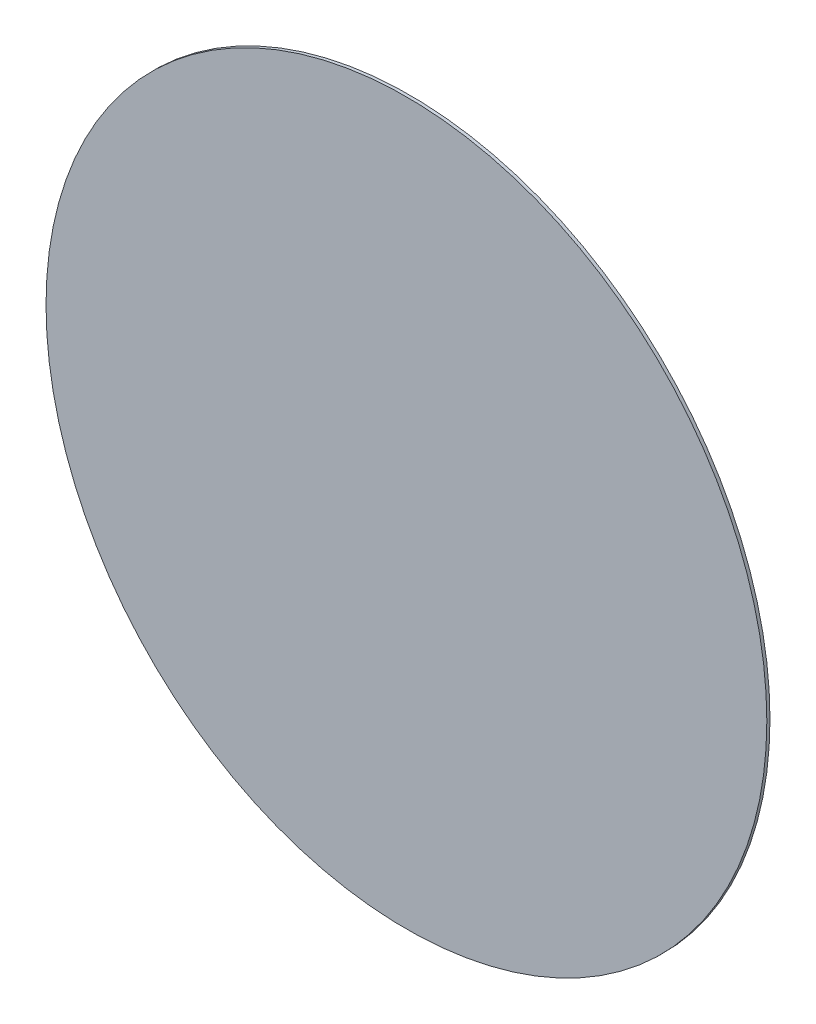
SolidWorks part; units mm, degrees
ref_plane "Front" through (0, 0, 0) normal (0, 0, 1) x (1, 0, 0)
ref_plane "Top" through (0, 0, 0) normal (0, 1, 0) x (1, 0, 0)
ref_plane "Right" through (0, 0, 0) normal (1, 0, 0) x (0, 0, -1)
sketch "Sketch1" plane through (0, 0, 0) normal (0, 0, 1) x (1, 0, 0)
  circle A0 centre (0, 0) radius 12.5
  dimension "D1" = 25
extrude "Extrude1" add sketch "Sketch1" along normal blind 0.1092
